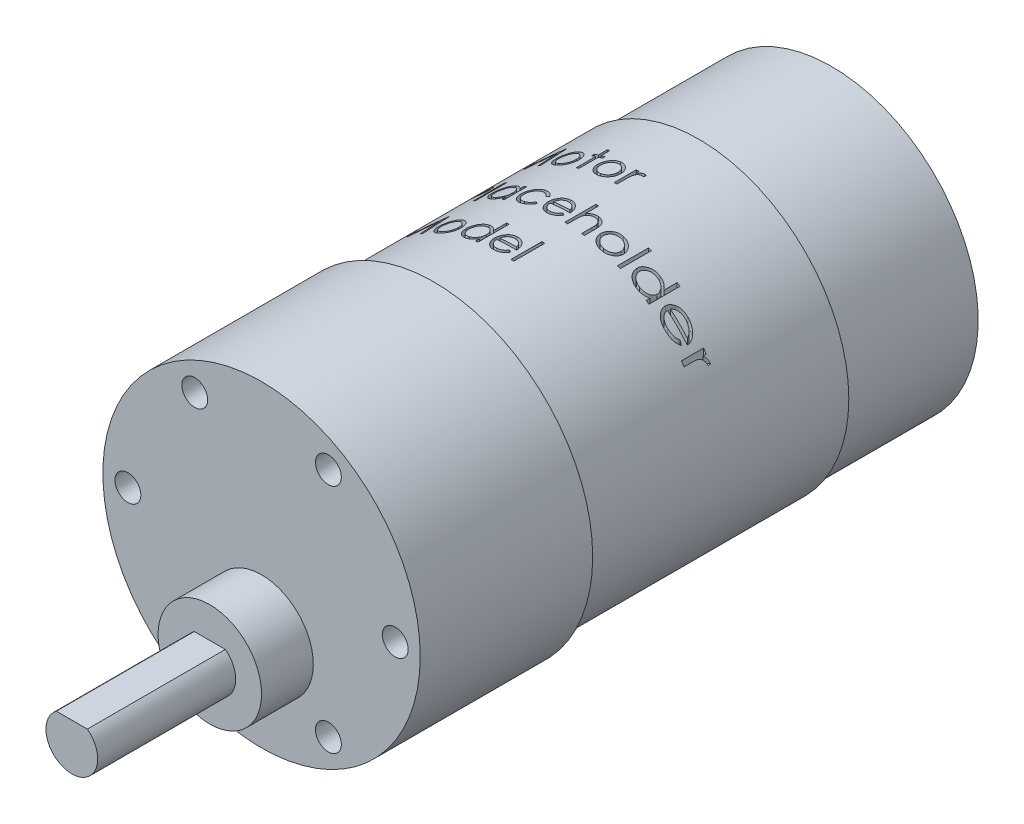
SolidWorks part; units mm, degrees
ref_plane "Front Plane" through (0, 0, 0) normal (0, 0, 1) x (1, 0, 0)
ref_plane "Top Plane" through (0, 0, 0) normal (0, 1, 0) x (1, 0, 0)
ref_plane "Right Plane" through (0, 0, 0) normal (1, 0, 0) x (0, 0, -1)
sketch "Sketch1" plane through (0, 0, 0) normal (0, 0, 1) x (1, 0, 0)
  circle A0 centre (0, 0) radius 17
  dimension "D1" = 34
extrude "Boss-Extrude1" add sketch "Sketch1" along normal blind 15.4
sketch "Sketch2" plane through (0, 0, 15.4) normal (0, 0, 1) x (1, 0, 0)
  circle A0 centre (0, 0) radius 17.4
  dimension "D1" = 34.8
extrude "Boss-Extrude2" add sketch "Sketch2" along normal blind 30.7
sketch "Sketch3" plane through (0, 0, 46.1) normal (0, 0, 1) x (1, 0, 0)
  circle A0 centre (0, 0) radius 18.4
  dimension "D1" = 36.8
extrude "Boss-Extrude3" add sketch "Sketch3" along normal blind 20
sketch "Sketch4" plane through (0, 0, 66.1) normal (0, 0, 1) x (1, 0, 0)
  circle A0 centre (0, -7) radius 6
  dimension "D2" = 12
  dimension "D1" = 7
extrude "Boss-Extrude4" add sketch "Sketch4" along normal blind 6
sketch "Sketch5" plane through (0, 0, 72.1) normal (0, 0, 1) x (1, 0, 0)
  circle A0 centre (0, -7) radius 3
  dimension "D1" = 6
extrude "Boss-Extrude5" add sketch "Sketch5" along normal blind 16
sketch "Sketch6" plane through (0, 0, 88.1) normal (0, 0, 1) x (1, 0, 0)
  line L1 (-1.8, -4.6) -> (1.8, -4.6)
  line L2 (-1.8, -4.6) -> (-1.8, -4)
  line L3 (-1.8, -4) -> (1.8, -4)
  line L4 (1.8, -4.6) -> (1.8, -4)
  circle A0 centre (0, -7) radius 3 construction
  circle A1 centre (0, -7) radius 3 construction
  dimension "D1" = 0.6
extrude "Cut-Extrude1" cut sketch "Sketch6" against normal blind 16
sketch "Sketch7" plane through (0, 0, 66.1) normal (0, 0, 1) x (1, 0, 0)
  line L0 (7.75, 13.4234) -> (-7.75, 13.4234) construction
  line L1 (-7.75, 13.4234) -> (-15.5, 0) construction
  line L2 (-15.5, 0) -> (-7.75, -13.4234) construction
  line L3 (-7.75, -13.4234) -> (7.75, -13.4234) construction
  line L4 (7.75, -13.4234) -> (15.5, 0) construction
  line L5 (15.5, 0) -> (7.75, 13.4234) construction
  line L6 (7.75, 13.4234) -> (-7.75, -13.4234) construction
  line L7 (-7.75, 13.4234) -> (7.75, -13.4234) construction
  line L8 (-15.5, 0) -> (15.5, 0) construction
  circle A0 centre (7.75, -13.4234) radius 1.5
  circle A1 centre (-7.75, -13.4234) radius 1.5
  circle A2 centre (-15.5, 0) radius 1.5
  circle A3 centre (15.5, 0) radius 1.5
  circle A4 centre (7.75, 13.4234) radius 1.5
  circle A5 centre (-7.75, 13.4234) radius 1.5
  point P12 (0, 0)
  point P13 (-7.7656, 13.4054)
  dimension "D2" = 3
  dimension "D1" = 15.5
  dimension "D3" = 31
  dimension "D4" = 15.5
  dimension "D5" = 15.5
  dimension "D6" = 31
  dimension "D7" = 31
extrude "Cut-Extrude2" cut sketch "Sketch7" against normal blind 3
ref_plane "Plane1" through (0, 20, 0) normal (0, 1, 0) x (1, 0, 0)
sketch "Sketch8" plane through (0, 20, 0) normal (0, 1, 0) x (1, 0, 0)
  text T0 "Motor  Placeholder  Model"
extrude "Cut-Extrude3" cut sketch "Sketch8" against normal blind 11
